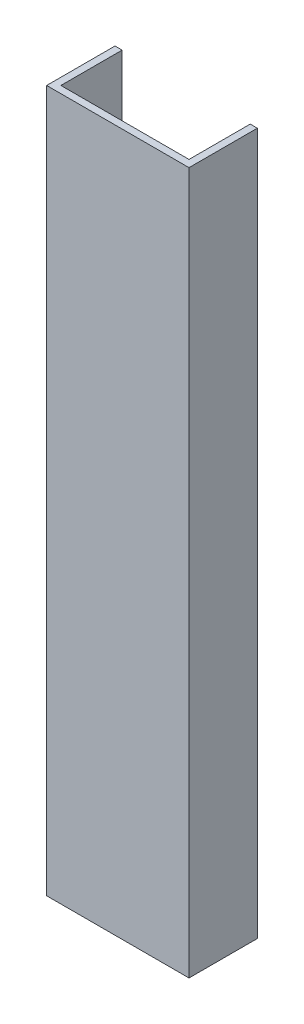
SolidWorks part; units mm, degrees
ref_plane "Front Plane" through (0, 0, 0) normal (0, 0, 1) x (1, 0, 0)
ref_plane "Top Plane" through (0, 0, 0) normal (0, 1, 0) x (1, 0, 0)
ref_plane "Right Plane" through (0, 0, 0) normal (1, 0, 0) x (0, 0, -1)
sketch "Sketch1" plane through (0, 0, 0) normal (0, 1, 0) x (1, 0, 0)
  line L0 (45, 48) -> (45, 5)
  line L1 (-50, 0) -> (50, 0)
  line L2 (-50, 0) -> (-50, 48)
  line L3 (-50, 48) -> (-45, 48)
  line L4 (50, 0) -> (50, 48)
  line L5 (45, 5) -> (-45, 5)
  line L6 (-45, 5) -> (-45, 48)
  line L7 (45, 48) -> (50, 48)
  dimension "D3" = 5
  dimension "D1" = 100
  dimension "D2" = 48
  dimension "D4" = 5
extrude "Boss-Extrude1" add sketch "Sketch1" along normal blind 493
